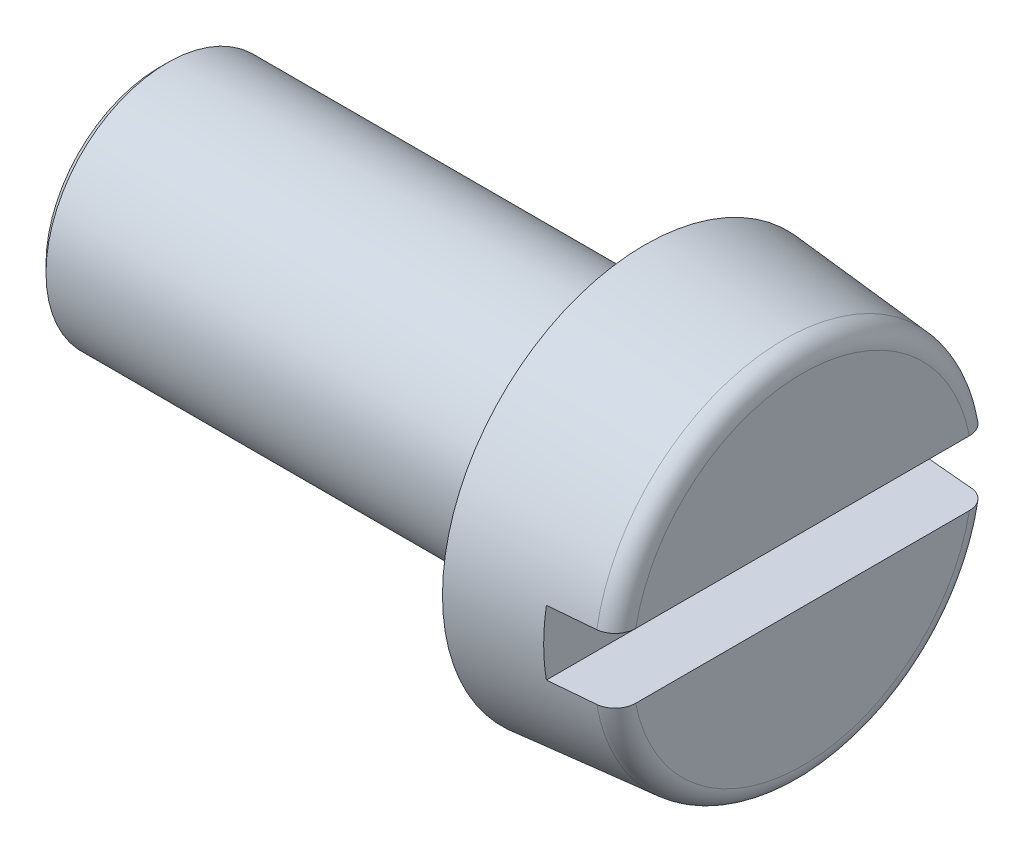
SolidWorks part; units mm, degrees
ref_plane "plan1" through (0, 0, 0) normal (0, 0, 1) x (1, 0, 0)
ref_plane "plan2" through (0, 0, 0) normal (0, 1, 0) x (1, 0, 0)
ref_plane "plan3" through (0, 0, 0) normal (1, 0, 0) x (0, 0, -1)
sketch "Esquisse1" plane through (0, 0, 0) normal (0, 0, -1) x (0, 1, 0)
  line L0 (0, -11.6119) -> (0, 2.7231) construction
  line L1 (0, 3.9) -> (4.2006, 3.9)
  line L2 (4.6987, 3.4436) -> (5, 0)
  line L3 (5, 0) -> (3, 0)
  line L4 (3, 0) -> (3, -12)
  line L5 (0, -12) -> (3, -12)
  line L6 (0, 3.9) -> (0, -12)
  arc A0 (4.2006, 3.9) -> (4.6987, 3.4436) centre (4.2006, 3.4) cw
  dimension "D5" = 0.5
  dimension "D1" = 6
  dimension "D2" = 85
  dimension "Hauteur de tete" = 3.9
  dimension "Longueur de tige" = 12
  dimension "Ø tete" = 10
revolve "Base-Révolution" add sketch "Esquisse1" angle 360 about L0
sketch "Esquisse2" plane through (3.9, 0, 0) normal (1, 0, 0) x (0, 0, -1)
  line L0 (0, 0) -> (438.5626, 0) construction
  line L1 (4.9356, 0.8) -> (-4.9356, 0.8)
  line L2 (4.9356, -0.8) -> (-4.9356, -0.8)
  circle A1 centre (0, 0) radius 5 construction
  arc A2 (-4.9356, 0.8) -> (-4.9356, -0.8) centre (0, 0) ccw
  arc A5 (4.9356, -0.8) -> (4.9356, 0.8) centre (0, 0) ccw
  dimension "D1" = 1.6
extrude "Enlèv. mat.-Extru.1" cut sketch "Esquisse2" against normal blind 1.6
chamfer "Chanfrein1" distance 0.2 angle 45 1 edges at (-12, 0, 3)
other "Bloquer***"
